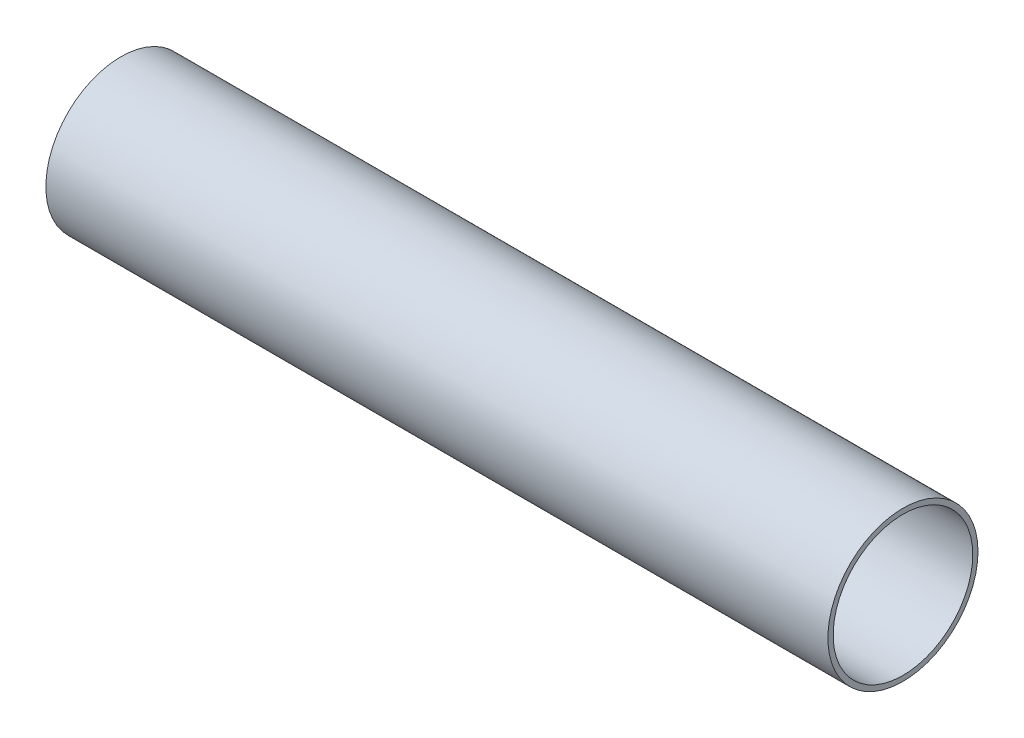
SolidWorks part; units mm, degrees
ref_plane "Front Plane" through (0, 0, 0) normal (0, 0, 1) x (1, 0, 0)
ref_plane "Top Plane" through (0, 0, 0) normal (0, 1, 0) x (1, 0, 0)
ref_plane "Right Plane" through (0, 0, 0) normal (1, 0, 0) x (0, 0, -1)
sketch "Sketch1" plane through (0, 0, 0) normal (1, 0, 0) x (0, 0, -1)
  circle A0 centre (0, 0) radius 29.083
  circle A1 centre (0, 0) radius 27.051
  dimension "D1" = 58.166
  dimension "D2" = 54.102
extrude "Extrude1" add sketch "Sketch1" along normal blind 303.022
